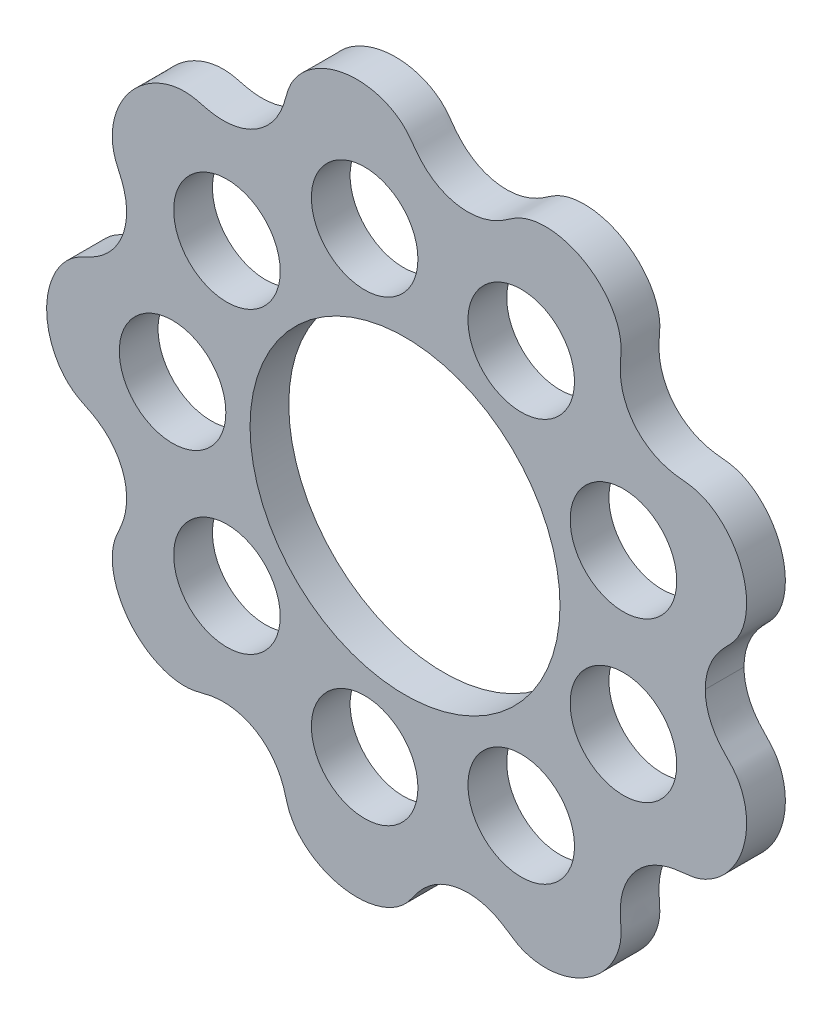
SolidWorks part; units mm, degrees
ref_plane "Front Plane" through (0, 0, 0) normal (0, 0, 1) x (1, 0, 0)
ref_plane "Top Plane" through (0, 0, 0) normal (0, 1, 0) x (1, 0, 0)
ref_plane "Right Plane" through (0, 0, 0) normal (1, 0, 0) x (0, 0, -1)
sketch "Sketch1" plane through (0, 0, 0) normal (0, 0, 1) x (1, 0, 0)
  line L0 (-266.5635, 0) -> (296.6747, 0) construction
  spline S0 degree 4 number of poles 320 (195.679, 108.3743) -> (-183.698, 91.1773) construction
  spline S1 degree 4 number of poles 196 (196.85, 0) -> (-234.95, 0)
  spline S2 degree 4 number of poles 196 (196.85, 0) -> (-234.95, 0)
extrude "Boss-Extrude1" add sketch "Sketch1" along normal mid plane 25.4
sketch "Sketch2" plane through (0, 0, 12.7) normal (0, 0, 1) x (1, 0, 0)
  circle A0 centre (0, 0) radius 101.6127
  circle A1 centre (0, 0) radius 152.4 construction
  circle A2 centre (-152.4, 0) radius 34.925
  circle A3 centre (-116.7452, 97.9608) radius 34.925
  circle A4 centre (-26.464, 150.0847) radius 34.925
  circle A5 centre (76.2, 131.9823) radius 34.925
  circle A6 centre (143.2092, 52.1239) radius 34.925
  circle A7 centre (143.2092, -52.1239) radius 34.925
  circle A8 centre (76.2, -131.9823) radius 34.925
  circle A9 centre (-26.464, -150.0847) radius 34.925
  circle A10 centre (-116.7452, -97.9608) radius 34.925
  point P25 (0, 0)
  dimension "D1" = 203.2254
  dimension "D2" = 304.8
  dimension "D3" = 69.85
  dimension "D4" = 9
extrude "Cut-Extrude1" cut sketch "Sketch2" against normal through all
